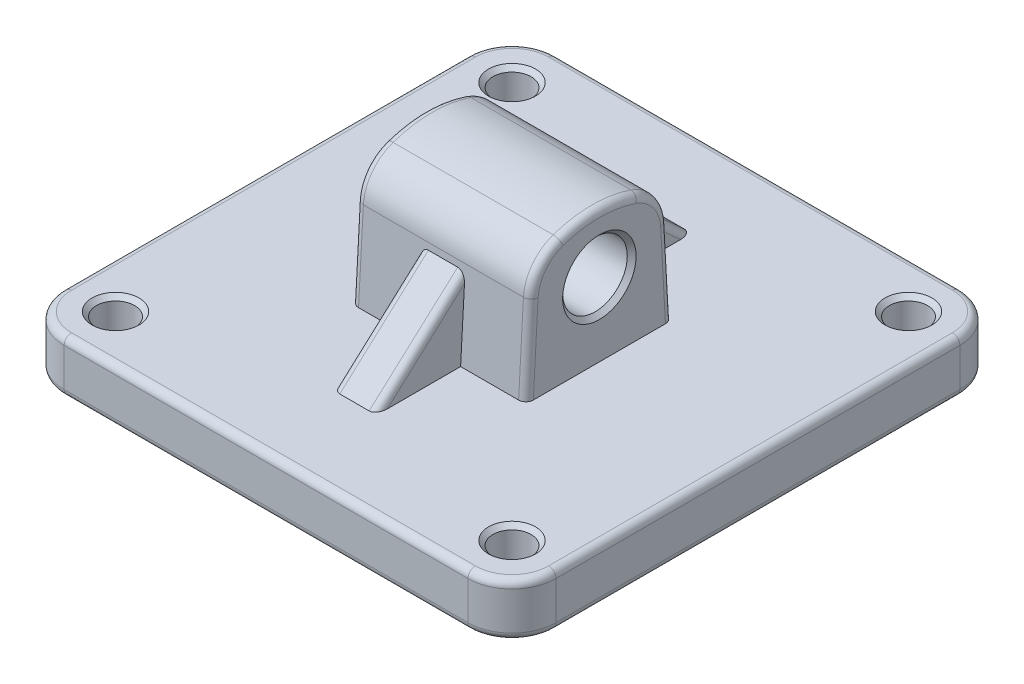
SolidWorks part; units mm, degrees
ref_plane "Front" through (0, 0, 0) normal (0, 0, 1) x (1, 0, 0)
ref_plane "Top" through (0, 0, 0) normal (0, 1, 0) x (1, 0, 0)
ref_plane "Right" through (0, 0, 0) normal (1, 0, 0) x (0, 0, -1)
sketch "Çizim2" plane through (0, 0, 0) normal (0, 1, 0) x (1, 0, 0)
  line L2 (-167.5, 137.5) -> (-167.5, -137.5)
  line L3 (-137.5, -167.5) -> (137.5, -167.5)
  line L4 (167.5, 137.5) -> (167.5, -137.5)
  line L5 (-137.5, 167.5) -> (137.5, 167.5)
  arc A0 (137.5, 167.5) -> (167.5, 137.5) centre (137.5, 137.5) cw
  arc A1 (137.5, -167.5) -> (167.5, -137.5) centre (137.5, -137.5) ccw
  arc A2 (-137.5, -167.5) -> (-167.5, -137.5) centre (-137.5, -137.5) cw
  circle A3 centre (-135, 135) radius 13
  circle A4 centre (135, 135) radius 13
  circle A5 centre (135, -135) radius 13
  circle A6 centre (-135, -135) radius 13
  arc A8 (-137.5, 167.5) -> (-167.5, 137.5) centre (-137.5, 137.5) ccw
  dimension "D1" = 26
extrude "Yükseklik-Ekstrüzyon1" add sketch "Çizim2" along normal blind 36
sketch "Çizim20" plane through (0, 0, 0) normal (0, -1, 0) x (1, 0, 0)
  circle A0 centre (0, 0) radius 120
  dimension "D1" = 240
extrude "Kes-Ekstrüzyon3" cut sketch "Çizim20" against normal blind 15 draft 22
ref_plane "Düzlem3" through (59.5, 0, 0) normal (1, 0, 0) x (0, 0, -1)
sketch "Çizim25" plane through (59.5, 0, 0) normal (1, 0, 0) x (0, 0, -1)
  line L0 (-50, 36) -> (50, 36)
  line L5 (-46.7268, 94.9959) -> (-50, 36)
  line L9 (46.7268, 94.9959) -> (50, 36)
  arc A0 (46.7268, 94.9959) -> (26.469, 121.7239) centre (16.7729, 93.334) ccw
  arc A1 (-46.7268, 94.9959) -> (-26.469, 121.7239) centre (-16.7729, 93.334) cw
  circle A3 centre (0, 86) radius 22
  arc A4 (-26.469, 121.7239) -> (26.469, 121.7239) centre (0, 44.2236) cw
  dimension "D2" = 30
  dimension "D1" = 44
extrude "Yükseklik-Ekstrüzyon3" add sketch "Çizim25" against normal blind 119
ref_plane "Düzlem4" through (0, 0, 0) normal (1, 0, 0) x (0, 0, -1)
sketch "Çizim26" plane through (0, 0, 0) normal (1, 0, 0) x (0, 0, -1)
  line L0 (46.9703, 90.6072) -> (107.6567, 35.6707)
  line L2 (50, 36) -> (46.7268, 94.9959) construction
rib "Feder2" sketch "Çizim26" sketch "Çizim26" thickness 30 extrusion direction parallel to sketch draft on no parameters "D1"=30
mirror "Aynalama3" about plane through (0, 0, 0) normal (0, 0, 1) of "Feder2"
fillet "Radyus1" radius 5 30 edges at (158.7132, 0, 158.7132) (0, 0, 167.5) (-158.7132, 0, 158.7132) (-167.5, 0, 0) (-158.7132, 0, -158.7132) (0, 0, -167.5) (158.7132, 0, -158.7132) (158.7132, 36, 158.7132) (0, 36, 167.5) (-158.7132, 36, 158.7132) (-167.5, 36, 0) (-158.7132, 36, -158.7132) (0, 36, -167.5) (158.7132, 36, -158.7132) (-15, 63.3036, -77.1317) (15, 63.3036, -77.1317) (-15, 63.3036, 77.1317) (15, 63.3036, 77.1317) (167.5, 0, 0) (167.5, 36, 0) (-59.5, 65.4979, -48.3634) (-59.5, 111.455, -40.6816) (-59.5, 126.1192, 0) (-59.5, 111.455, 40.6816) (59.5, 65.4979, -48.3634) (59.5, 111.455, -40.6816) (59.5, 126.1192, 0) (59.5, 111.455, 40.6816) (-59.5, 65.4979, 48.3634) (59.5, 65.4979, 48.3634)
chamfer "Pah1" distance 3 angle 45 10 edges at (-135, 0, -122) (135, 0, -148) (135, 0, 148) (-135, 0, 122) (135, 36, -148) (135, 36, 148) (-135, 36, 122) (-135, 36, -122) (59.5, 86, -22) (-59.5, 86, -22)
